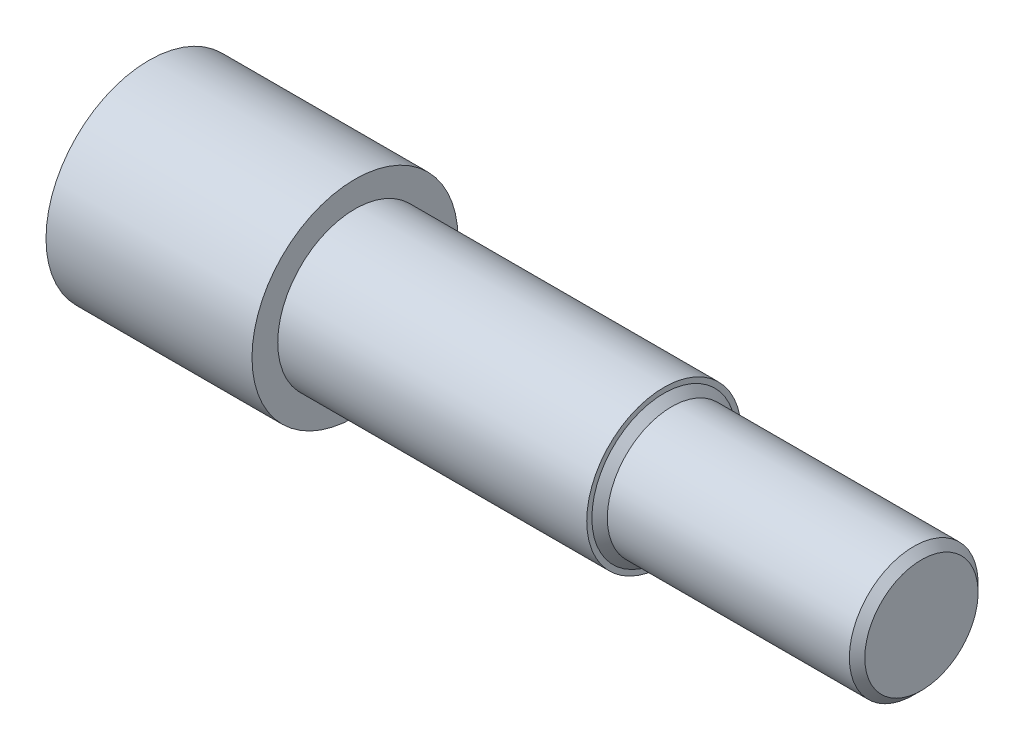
SolidWorks part; units mm, degrees
ref_plane "前视基准面" through (0, 0, 0) normal (0, 0, 1) x (1, 0, 0)
ref_plane "上视基准面" through (0, 0, 0) normal (0, 1, 0) x (1, 0, 0)
ref_plane "右视基准面" through (0, 0, 0) normal (1, 0, 0) x (0, 0, -1)
other "Configuration Table"
sketch "草图1" plane through (0, 0, 0) normal (0, 0, 1) x (1, 0, 0)
  line L0 (0, 0) -> (150, 0) construction
  line L1 (0, 0) -> (0, 20)
  line L2 (0, 20) -> (40, 20)
  line L3 (40, 20) -> (40, 15)
  line L4 (40, 15) -> (100, 15)
  line L5 (100, 15) -> (100, 12.5)
  line L6 (100, 12.5) -> (150, 12.5)
  line L7 (150, 12.5) -> (150, 0)
  line L8 (150, 0) -> (0, 0)
revolve "旋转1" add sketch "草图1" angle 360 about L0
sketch "草图2" plane through (0, 0, 0) normal (0, 1, 0) x (1, 0, 0)
  line L1 (50, -4) -> (80, -4)
  line L2 (50, -4) -> (50, 4)
  line L3 (50, 4) -> (80, 4)
  line L4 (80, -4) -> (80, 4)
  line L5 (50, -4) -> (80, 4) construction
  line L6 (50, 4) -> (80, -4) construction
  point P0 (65, 0)
extrude "切除-拉伸1" cut sketch "草图2" against normal blind 19
chamfer "倒角1" distance 1.5 angle 45 2 edges at (150, 0, 12.5) (100, 0, 12.5)
